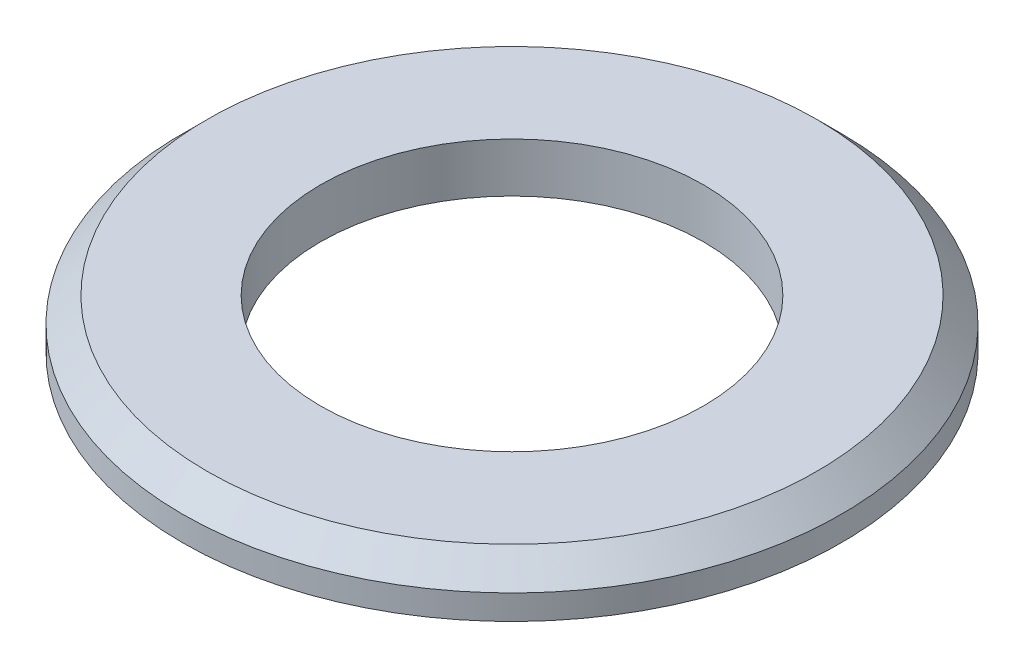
SolidWorks part; units mm, degrees
ref_plane "Front" through (0, 0, 0) normal (0, 0, 1) x (1, 0, 0)
ref_plane "Top" through (0, 0, 0) normal (0, 1, 0) x (1, 0, 0)
ref_plane "Right" through (0, 0, 0) normal (1, 0, 0) x (0, 0, -1)
sketch "Sketch1" plane through (0, 0, 0) normal (0, 1, 0) x (1, 0, 0)
  circle A0 centre (0, 0) radius 46.5
  circle A1 centre (0, 0) radius 80
extrude "Extrude1" add sketch "Sketch1" along normal blind 12
chamfer "Chamfer1" distance 6 1 edges at (0, 12, 80)
